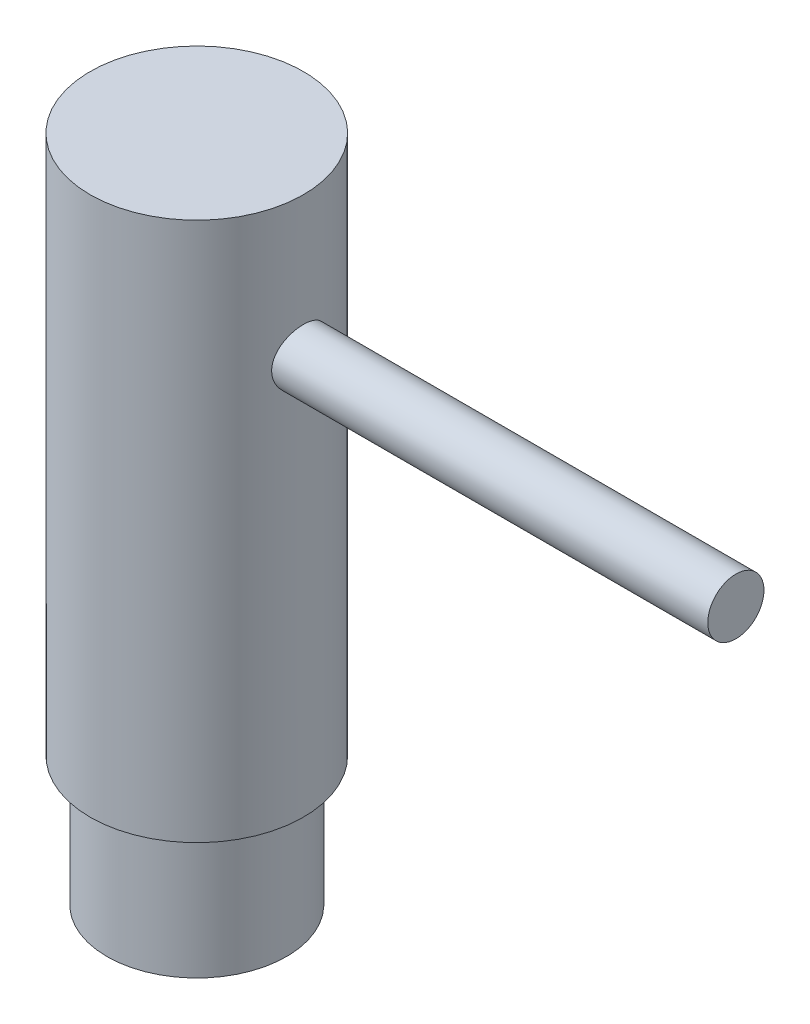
SolidWorks part; units mm, degrees
ref_plane "Front Plane" through (0, 0, 0) normal (0, 0, 1) x (1, 0, 0)
ref_plane "Top Plane" through (0, 0, 0) normal (0, 1, 0) x (1, 0, 0)
ref_plane "Right Plane" through (0, 0, 0) normal (1, 0, 0) x (0, 0, -1)
sketch "Sketch1" plane through (0, 0, 0) normal (0, 1, 0) x (1, 0, 0)
  circle A0 centre (0, 0) radius 16
  dimension "D1" = 32
extrude "Boss-Extrude1" add sketch "Sketch1" along normal blind 23
sketch "Sketch2" plane through (0, 23, 0) normal (0, 1, 0) x (1, 0, 0)
  circle A0 centre (0, 0) radius 19
  dimension "D1" = 38
extrude "Boss-Extrude2" add sketch "Sketch2" along normal blind 96
ref_plane "Plane1" through (0, 94, 0) normal (0, 1, 0) x (1, 0, 0)
sketch "Sketch3" plane through (0, 94, 0) normal (0, 1, 0) x (1, 0, 0)
  line L0 (0, 0) -> (96, 0)
  circle A0 centre (0, 0) radius 19 construction
  dimension "D1" = 77
sketch "Sketch4" plane through (0, 0, 0) normal (1, 0, 0) x (0, 0, -1)
  circle A0 centre (0, 94) radius 5
  dimension "D1" = 10
sweep "Sweep1" add profiles "Sketch4" path "Sketch3"
